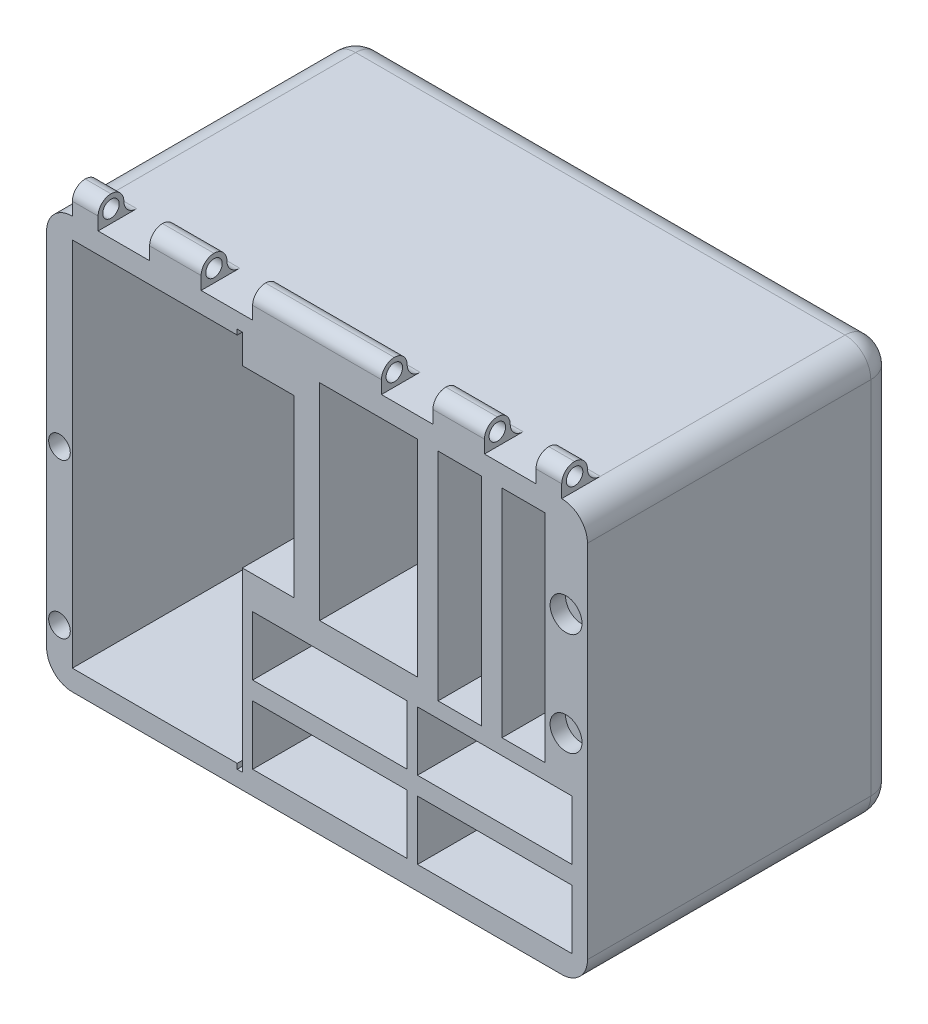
SolidWorks part; units mm, degrees
ref_plane "前视基准面" through (0, 0, 0) normal (0, 0, 1) x (1, 0, 0)
ref_plane "上视基准面" through (0, 0, 0) normal (0, 1, 0) x (1, 0, 0)
ref_plane "右视基准面" through (0, 0, 0) normal (1, 0, 0) x (0, 0, -1)
sketch "草图1" plane through (0, 0, 0) normal (0, 0, 1) x (1, 0, 0)
  line L1 (-52.5, -40) -> (52.5, -40)
  line L2 (-52.5, -40) -> (-52.5, 40)
  line L3 (-52.5, 40) -> (52.5, 40)
  line L4 (52.5, -40) -> (52.5, 40)
  line L5 (-52.5, -40) -> (52.5, 40) construction
  line L6 (-52.5, 40) -> (52.5, -40) construction
  point P0 (0, 0)
  dimension "D1" = 80
  dimension "D2" = 105
extrude "凸台-拉伸1" add sketch "草图1" along normal blind 60
sketch "草图2" plane through (0, 0, 60) normal (0, 0, 1) x (1, 0, 0)
  line L0 (-52.5, 0) -> (52.5, 0) construction
  line L2 (-47.5, -36) -> (-14.5, -36)
  line L3 (-47.5, -36) -> (-47.5, 36)
  line L4 (52.5, -40) -> (52.5, 40)
  line L5 (52.5, 40) -> (-52.5, 40)
  line L6 (-52.5, 40) -> (-52.5, -40)
  line L7 (-52.5, -40) -> (52.5, -40)
  line L8 (52.5, -40) -> (52.5, 40)
  line L9 (52.5, 40) -> (-52.5, 40)
  line L10 (-52.5, 40) -> (-52.5, -40)
  line L11 (-52.5, -40) -> (52.5, -40)
  line L12 (-47.5, 36) -> (-14.5, 36)
  line L13 (-14.5, -36) -> (-14.5, 36)
  line L14 (-47.5, -36) -> (-14.5, 36) construction
  line L15 (-47.5, 36) -> (-14.5, -36) construction
  line L16 (-24.5, 31.35) -> (-4.5, 31.35)
  line L17 (-24.5, 31.35) -> (-24.5, -2.65)
  line L18 (-24.5, -2.65) -> (-4.5, -2.65)
  line L19 (-4.5, 31.35) -> (-4.5, -2.65)
  line L20 (-24.5, 31.35) -> (-4.5, -2.65) construction
  line L21 (-24.5, -2.65) -> (-4.5, 31.35) construction
  point P6 (-31, 0)
  point P11 (-14.5, 14.35)
  dimension "D2" = 33
  dimension "D3" = 72
  dimension "D4" = 5
  dimension "D5" = 50.35
  dimension "D6" = 34
  dimension "D7" = 43
  dimension "D1" = 0
extrude "切除-拉伸1" cut sketch "草图2" against normal blind 50 contours L18 L17 L16 L13 L12 L3 L2 | L19 L16 L13 L18 | L17 L18 L13 L16
fillet "圆角1" radius 5 4 edges at (52.5, -40, 30) (52.5, 40, 30) (-52.5, 40, 30) (-52.5, -40, 30)
sketch "草图3" plane through (0, 0, 60) normal (0, 0, 1) x (1, 0, 0)
  line L0 (-14.5, 36) -> (52.399, 36) construction
  line L1 (-4.5, 31.35) -> (-4.5, -2.65) construction
  line L2 (0.5, 36) -> (19.5, 36)
  line L3 (0.5, 36) -> (0.5, -4)
  line L4 (0.5, -4) -> (19.5, -4)
  line L5 (19.5, 36) -> (19.5, -4)
  arc A0 (52.5, 35) -> (47.5, 40) centre (47.5, 35) ccw construction
  dimension "D1" = 40
  dimension "D2" = 19
  dimension "D3" = 5
extrude "切除-拉伸2" cut sketch "草图3" against normal blind 45
sketch "草图4" plane through (0, 0, 60) normal (0, 0, 1) x (1, 0, 0)
  line L0 (-14.5, 36) -> (46.9444, 36) construction
  line L1 (19.5, -4) -> (19.5, 36) construction
  line L2 (23.5, 36) -> (31.9, 36)
  line L3 (23.5, 36) -> (23.5, -6)
  line L4 (23.5, -6) -> (31.9, -6)
  line L5 (31.9, 36) -> (31.9, -6)
  line L6 (35.9, 36) -> (44.3, 36)
  line L7 (35.9, 36) -> (35.9, -6)
  line L8 (35.9, -6) -> (44.3, -6)
  line L9 (44.3, 36) -> (44.3, -6)
  dimension "D1" = 42
  dimension "D2" = 42
  dimension "D3" = 8.4
  dimension "D4" = 8.4
  dimension "D5" = 4
  dimension "D6" = 4
extrude "切除-拉伸3" cut sketch "草图4" against normal blind 45
sketch "草图5" plane through (0, 0, 60) normal (0, 0, 1) x (1, 0, 0)
  line L0 (44.3, -6) -> (-14.5, -6) construction
  line L1 (-14.5, -36) -> (-14.5, -2.65) construction
  line L2 (-14.5, -6) -> (-14.5, -40) construction
  line L3 (-47.5, -40) -> (47.5, -40) construction
  line L4 (-14.5, -9) -> (52.5, -9) construction
  line L5 (52.5, -35) -> (52.5, 35) construction
  line L6 (19.5, -9) -> (49.5, -9)
  line L7 (-12.5, -9) -> (17.5, -9)
  line L8 (-12.5, -9) -> (-12.5, -20.5)
  line L9 (-12.5, -20.5) -> (17.5, -20.5)
  line L10 (17.5, -9) -> (17.5, -20.5)
  line L11 (19.5, -9) -> (19.5, -20.5)
  line L12 (19.5, -20.5) -> (49.5, -20.5)
  line L13 (49.5, -9) -> (49.5, -20.5)
  line L14 (-12.5, -24) -> (-12.5, -35.5)
  line L15 (-12.5, -24) -> (17.5, -24)
  line L16 (17.5, -24) -> (17.5, -35.5)
  line L17 (-12.5, -35.5) -> (17.5, -35.5)
  line L18 (19.5, -24) -> (49.5, -24)
  line L19 (49.5, -24) -> (49.5, -35.5)
  line L20 (19.5, -35.5) -> (49.5, -35.5)
  line L21 (19.5, -24) -> (19.5, -35.5)
  dimension "D1" = 3
  dimension "D2" = 30
  dimension "D3" = 11.5
  dimension "D4" = 2
  dimension "D5" = 2
  dimension "D6" = 30
  dimension "D7" = 11.5
  dimension "D8" = 2
extrude "切除-拉伸4" cut sketch "草图5" against normal blind 29
fillet "圆角2" radius 5 8 edges at (-51.0355, -38.5355, 0) (-52.5, 0, 0) (-51.0355, 38.5355, 0) (0, 40, 0) (51.0355, 38.5355, 0) (52.5, 0, 0) (51.0355, -38.5355, 0) (0, -40, 0)
sketch "草图7" plane through (0, 0, 60) normal (0, 0, 1) x (1, 0, 0)
  line L0 (-52.5, 0) -> (52.5, 0) construction
  line L1 (-52.5, 35) -> (-52.5, -35) construction
  line L2 (52.5, -35) -> (52.5, 35) construction
  line L3 (-47.5, 36) -> (-14.5, 36) construction
  line L4 (-15.5, -37) -> (-14.5, -37)
  line L5 (-15.5, -37) -> (-15.5, 37)
  line L6 (-15.5, 37) -> (-14.5, 37)
  line L7 (-14.5, -37) -> (-14.5, 37)
  line L8 (-15.5, -37) -> (-14.5, 37) construction
  line L9 (-15.5, 37) -> (-14.5, -37) construction
  point P6 (-15, 0)
  point P12 (0, 0)
  point P13 (0, 0)
  dimension "D1" = 1
  dimension "D2" = 1
extrude "切除-拉伸5" cut sketch "草图7" against normal up to surface (50 mm away)
sketch "草图8" plane through (0, 40, 0) normal (0, 1, 0) x (1, 0, 0)
  line L0 (47.5, -60) -> (47.5, -5) construction
  line L1 (-47.5, -60) -> (47.5, -60)
  line L2 (-47.5, -60) -> (-47.5, -55)
  line L3 (-47.5, -55) -> (47.5, -55)
  line L4 (47.5, -60) -> (47.5, -55)
  dimension "D1" = 5
extrude "凸台-拉伸2" add sketch "草图8" along normal blind 5
sketch "草图9" plane through (47.5, 0, 0) normal (1, 0, 0) x (0, 0, -1)
  line L0 (-60, 45) -> (-55, 40) construction
  circle A0 centre (-57.5, 42.5) radius 1.6
  dimension "D1" = 3.2
extrude "切除-拉伸6" cut sketch "草图9" against normal through all contours A0
fillet "圆角3" radius 2.5 3 edges at (0, 40, 55) (0, 45, 55) (0, 45, 60)
sketch "草图10" plane through (0, 0, 60) normal (0, 0, 1) x (1, 0, 0)
  line L0 (0, 42.5) -> (0, -40) construction
  line L1 (47.5, 42.5) -> (-47.5, 42.5) construction
  line L2 (-47.5, -40) -> (47.5, -40) construction
  line L3 (-47.5, 40) -> (47.5, 40) construction
  line L4 (-47.5, 40) -> (47.5, 40)
  line L6 (-42.5, 45) -> (-32.5, 45)
  line L7 (-42.5, 45) -> (-42.5, 40)
  line L8 (-42.5, 40) -> (-32.5, 40)
  line L9 (-32.5, 45) -> (-32.5, 40)
  line L10 (-47.5, 42.5) -> (-47.5, 40) construction
  line L11 (-22.5, 45) -> (-12.5, 45)
  line L12 (-22.5, 45) -> (-22.5, 40)
  line L13 (-22.5, 40) -> (-12.5, 40)
  line L14 (-12.5, 45) -> (-12.5, 40)
  line L15 (22.5, 40) -> (12.5, 40)
  line L16 (12.5, 45) -> (12.5, 40)
  line L17 (22.5, 45) -> (12.5, 45)
  line L18 (22.5, 45) -> (22.5, 40)
  line L19 (42.5, 40) -> (32.5, 40)
  line L20 (32.5, 45) -> (32.5, 40)
  line L21 (42.5, 45) -> (32.5, 45)
  line L22 (42.5, 45) -> (42.5, 40)
  point P12 (0, 0)
  point P18 (-22.5, 42.5)
  point P29 (0, 0)
  point P30 (0, 0)
  dimension "D1" = 10
  dimension "D2" = 10
  dimension "D3" = 10
  dimension "D4" = 5
extrude "切除-拉伸7" cut sketch "草图10" against normal through all contours L9 L7 L4 M51 | L9 L6 L7 M51 | L14 L12 L4 M51 | L18 L16 L4 M51 | L22 L20 L4 M51 | L22 L21 L20 M51
sketch "草图11" plane through (0, 0, 60) normal (0, 0, 1) x (1, 0, 0)
  line L4 (-12.5, -24) -> (-12.5, -35.5)
  line L5 (17.5, -24) -> (-12.5, -24)
  line L6 (17.5, -35.5) -> (17.5, -24)
  line L7 (-12.5, -35.5) -> (17.5, -35.5)
  line L8 (-12.5, -24) -> (-12.5, -35.5)
  line L9 (17.5, -24) -> (-12.5, -24)
  line L10 (17.5, -35.5) -> (17.5, -24)
  line L11 (-12.5, -35.5) -> (17.5, -35.5)
  line L12 (19.5, -35.5) -> (49.5, -35.5)
  line L13 (19.5, -24) -> (19.5, -35.5)
  line L14 (49.5, -24) -> (19.5, -24)
  line L15 (49.5, -35.5) -> (49.5, -24)
  line L16 (19.5, -35.5) -> (49.5, -35.5)
  line L17 (19.5, -24) -> (19.5, -35.5)
  line L18 (49.5, -24) -> (19.5, -24)
  line L19 (49.5, -35.5) -> (49.5, -24)
  line L20 (19.5, -20.5) -> (49.5, -20.5)
  line L21 (19.5, -9) -> (19.5, -20.5)
  line L22 (-32.5, 42.5) -> (-32.5, 40)
  line L23 (-32.5, 40) -> (-42.5, 40)
  line L24 (-42.5, 40) -> (-42.5, 42.5)
  line L25 (-42.5, 42.5) -> (-47.5, 42.5)
  line L26 (-47.5, 42.5) -> (-47.5, 40)
  line L27 (-52.5, 35) -> (-52.5, -35)
  line L28 (-47.5, -40) -> (47.5, -40)
  line L29 (52.5, -35) -> (52.5, 35)
  line L30 (47.5, 40) -> (47.5, 42.5)
  line L31 (47.5, 42.5) -> (42.5, 42.5)
  line L32 (42.5, 42.5) -> (42.5, 40)
  line L33 (42.5, 40) -> (32.5, 40)
  line L34 (32.5, 40) -> (32.5, 42.5)
  line L35 (32.5, 42.5) -> (22.5, 42.5)
  line L36 (22.5, 42.5) -> (22.5, 40)
  line L37 (22.5, 40) -> (12.5, 40)
  line L38 (12.5, 40) -> (12.5, 42.5)
  line L39 (12.5, 42.5) -> (-12.5, 42.5)
  line L40 (-12.5, 42.5) -> (-12.5, 40)
  line L41 (-12.5, 40) -> (-22.5, 40)
  line L42 (-22.5, 40) -> (-22.5, 42.5)
  line L43 (-22.5, 42.5) -> (-32.5, 42.5)
  line L44 (-32.5, 42.5) -> (-32.5, 40)
  line L45 (-32.5, 40) -> (-42.5, 40)
  line L46 (-42.5, 40) -> (-42.5, 42.5)
  line L47 (-42.5, 42.5) -> (-47.5, 42.5)
  line L48 (-47.5, 42.5) -> (-47.5, 40)
  line L49 (-52.5, 35) -> (-52.5, -35)
  line L50 (-47.5, -40) -> (47.5, -40)
  line L51 (52.5, -35) -> (52.5, 35)
  line L52 (47.5, 40) -> (47.5, 42.5)
  line L53 (47.5, 42.5) -> (42.5, 42.5)
  line L54 (42.5, 42.5) -> (42.5, 40)
  line L55 (42.5, 40) -> (32.5, 40)
  line L56 (32.5, 40) -> (32.5, 42.5)
  line L57 (32.5, 42.5) -> (22.5, 42.5)
  line L58 (22.5, 42.5) -> (22.5, 40)
  line L59 (22.5, 40) -> (12.5, 40)
  line L60 (12.5, 40) -> (12.5, 42.5)
  line L61 (12.5, 42.5) -> (-12.5, 42.5)
  line L62 (-12.5, 42.5) -> (-12.5, 40)
  line L63 (-12.5, 40) -> (-22.5, 40)
  line L64 (-22.5, 40) -> (-22.5, 42.5)
  line L65 (-22.5, 42.5) -> (-32.5, 42.5)
  line L66 (49.5, -9) -> (19.5, -9)
  line L67 (49.5, -20.5) -> (49.5, -9)
  line L68 (19.5, -20.5) -> (49.5, -20.5)
  line L69 (19.5, -9) -> (19.5, -20.5)
  line L70 (49.5, -9) -> (19.5, -9)
  line L71 (49.5, -20.5) -> (49.5, -9)
  line L72 (-12.5, -20.5) -> (17.5, -20.5)
  line L73 (-12.5, -9) -> (-12.5, -20.5)
  line L74 (17.5, -9) -> (-12.5, -9)
  line L75 (17.5, -20.5) -> (17.5, -9)
  line L76 (-12.5, -20.5) -> (17.5, -20.5)
  line L77 (-12.5, -9) -> (-12.5, -20.5)
  line L78 (17.5, -9) -> (-12.5, -9)
  line L79 (17.5, -20.5) -> (17.5, -9)
  line L80 (35.9, -6) -> (44.3, -6)
  line L81 (35.9, 36) -> (35.9, -6)
  line L82 (44.3, 36) -> (35.9, 36)
  line L83 (44.3, -6) -> (44.3, 36)
  line L84 (35.9, -6) -> (44.3, -6)
  line L85 (35.9, 36) -> (35.9, -6)
  line L86 (44.3, 36) -> (35.9, 36)
  line L87 (44.3, -6) -> (44.3, 36)
  line L88 (23.5, -6) -> (31.9, -6)
  line L89 (23.5, 36) -> (23.5, -6)
  line L90 (31.9, 36) -> (23.5, 36)
  line L91 (31.9, -6) -> (31.9, 36)
  line L92 (23.5, -6) -> (31.9, -6)
  line L93 (23.5, 36) -> (23.5, -6)
  line L94 (31.9, 36) -> (23.5, 36)
  line L95 (31.9, -6) -> (31.9, 36)
  line L96 (0.5, -4) -> (19.5, -4)
  line L97 (0.5, 36) -> (0.5, -4)
  line L98 (19.5, 36) -> (0.5, 36)
  line L99 (19.5, -4) -> (19.5, 36)
  line L100 (0.5, -4) -> (19.5, -4)
  line L101 (0.5, 36) -> (0.5, -4)
  line L102 (19.5, 36) -> (0.5, 36)
  line L103 (19.5, -4) -> (19.5, 36)
  line L112 (-14.5, -37) -> (-14.5, -2.65)
  line L113 (-15.5, -37) -> (-14.5, -37)
  line L114 (-15.5, -36) -> (-15.5, -37)
  line L115 (-47.5, -36) -> (-15.5, -36)
  line L116 (-47.5, 36) -> (-47.5, -36)
  line L117 (-15.5, 36) -> (-47.5, 36)
  line L118 (-15.5, 37) -> (-15.5, 36)
  line L119 (-14.5, 37) -> (-15.5, 37)
  line L120 (-14.5, 31.35) -> (-14.5, 37)
  line L121 (-4.5, 31.35) -> (-14.5, 31.35)
  line L122 (-4.5, -2.65) -> (-4.5, 31.35)
  line L123 (-14.5, -2.65) -> (-4.5, -2.65)
  line L124 (-14.5, -37) -> (-14.5, -2.65)
  line L125 (-15.5, -37) -> (-14.5, -37)
  line L126 (-15.5, -36) -> (-15.5, -37)
  line L127 (-47.5, -36) -> (-15.5, -36)
  line L128 (-47.5, 36) -> (-47.5, -36)
  line L129 (-15.5, 36) -> (-47.5, 36)
  line L130 (-15.5, 37) -> (-15.5, 36)
  line L131 (-14.5, 37) -> (-15.5, 37)
  line L132 (-14.5, 31.35) -> (-14.5, 37)
  line L133 (-4.5, 31.35) -> (-14.5, 31.35)
  line L134 (-4.5, -2.65) -> (-4.5, 31.35)
  line L135 (-14.5, -2.65) -> (-4.5, -2.65)
  arc A4 (-47.5, 40) -> (-52.5, 35) centre (-47.5, 35) ccw
  arc A5 (-52.5, -35) -> (-47.5, -40) centre (-47.5, -35) ccw
  arc A6 (47.5, -40) -> (52.5, -35) centre (47.5, -35) ccw
  arc A7 (52.5, 35) -> (47.5, 40) centre (47.5, 35) ccw
  arc A8 (-47.5, 40) -> (-52.5, 35) centre (-47.5, 35) ccw
  arc A9 (-52.5, -35) -> (-47.5, -40) centre (-47.5, -35) ccw
  arc A10 (47.5, -40) -> (52.5, -35) centre (47.5, -35) ccw
  arc A11 (52.5, 35) -> (47.5, 40) centre (47.5, 35) ccw
  dimension "D1" = 0
  dimension "D2" = 0
  dimension "D3" = 0
  dimension "D4" = 0
  dimension "D5" = 0
  dimension "D6" = 0
  dimension "D7" = 0
  dimension "D8" = 0
  dimension "D9" = 0
sketch "草图12" plane through (0, 0, 60) normal (0, 0, 1) x (1, 0, 0)
  line L0 (-47.5, 0) -> (-52.5, 0) construction
  line L1 (-47.5, 36) -> (-47.5, -36) construction
  line L2 (-52.5, 35) -> (-52.5, -35) construction
  line L3 (-52.5, 0) -> (-50, 0) construction
  line L4 (-50, 0) -> (-50, -44.1832) construction
  line L5 (-47.5, -40) -> (47.5, -40) construction
  line L6 (44.3, 15) -> (52.5, 15) construction
  line L7 (44.3, -6) -> (44.3, 36) construction
  line L8 (52.5, -35) -> (52.5, 35) construction
  line L9 (52.5, 15) -> (48.3429, 15) construction
  line L10 (48.3429, 15) -> (48.3429, -9) construction
  line L11 (49.5, -9) -> (19.5, -9) construction
  circle A0 centre (-50, 0) radius 2.1
  circle A1 centre (-50, -30) radius 2.1
  circle A2 centre (48.3429, 1) radius 3.1
  circle A4 centre (48.3429, 21) radius 3.1
  dimension "D1" = 10
  dimension "D3" = 20
  dimension "D2" = 10
extrude "切除-拉伸8" cut sketch "草图12" against normal blind 3
